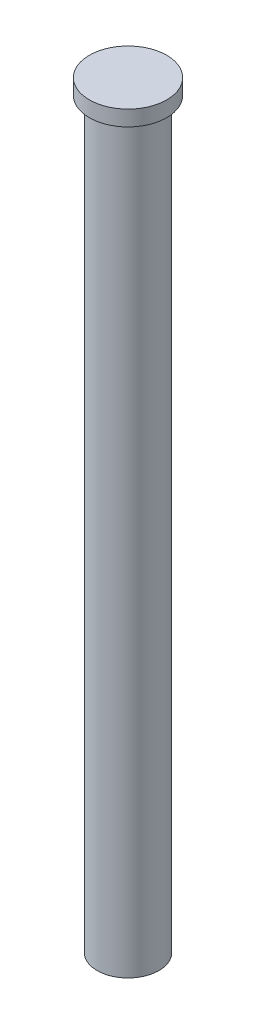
SolidWorks part; units mm, degrees
ref_plane "Front" through (0, 0, 0) normal (0, 0, 1) x (1, 0, 0)
ref_plane "Top" through (0, 0, 0) normal (0, 1, 0) x (1, 0, 0)
ref_plane "Right" through (0, 0, 0) normal (1, 0, 0) x (0, 0, -1)
sketch "Sketch2" plane through (0, 0, 0) normal (0, 0, 1) x (1, 0, 0)
  line L0 (0, 0) -> (0, 77.7875) construction
  line L1 (0, 77.7875) -> (3.9688, 77.7875)
  line L2 (3.9688, 77.7875) -> (3.9688, 76.2)
  line L3 (3.9688, 76.2) -> (3.175, 76.2)
  line L4 (3.175, 76.2) -> (3.175, 0)
  line L5 (3.175, 0) -> (0, 0)
  line L6 (0, 0) -> (0, 77.7875)
  dimension "D1" = 7.9375
  dimension "D2" = 6.35
  dimension "D3" = 76.2
  dimension "D4" = 1.5875
revolve "Base-Revolve" add sketch "Sketch2" angle 360 about L0
